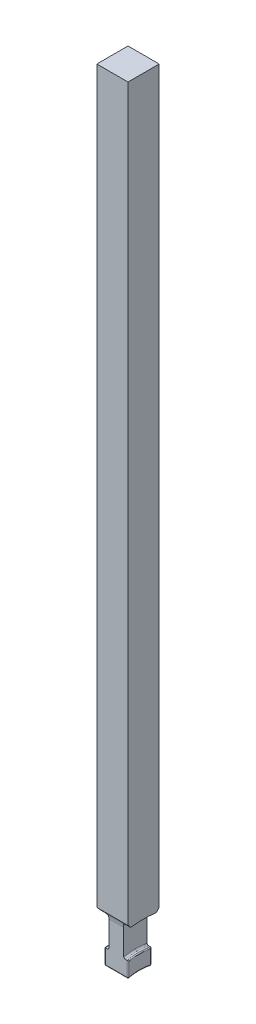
SolidWorks part; units mm, degrees
ref_plane "Front Plane" through (0, 0, 0) normal (0, 0, 1) x (1, 0, 0)
ref_plane "Top Plane" through (0, 0, 0) normal (0, 1, 0) x (1, 0, 0)
ref_plane "Right Plane" through (0, 0, 0) normal (1, 0, 0) x (0, 0, -1)
sketch "Sketch1" plane through (0, 0, 0) normal (1, 0, 0) x (0, 0, -1)
  line L0 (-4, 212) -> (-4, 0)
  line L1 (0, 249.2329) -> (0, 0) construction
  line L2 (4, 212) -> (4, 0)
  line L3 (-4, 212) -> (4, 212)
  line L6 (-4, 0) -> (4, 0)
  arc A0 (-12, 0) -> (12, 0) centre (0, 0) cw construction
  dimension "R" = 12
  dimension "L" = 200
  dimension "T" = 8
extrude "Boss-Extrude1" add sketch "Sketch1" along normal mid plane 8
sketch "Sketch8" plane through (0, 0, 0) normal (1, 0, 0) x (0, 0, -1)
  circle A0 centre (0, 0) radius 12
  arc A1 (12, 0) -> (-12, 0) centre (0, 0) ccw construction
extrude "Cut-Extrude4" cut sketch "Sketch8" against normal through all both and the other way through all
sketch "Sketch2" plane through (0, 0, 0) normal (0, 0, 1) x (1, 0, 0)
  line L0 (4, 16) -> (1.905, 16)
  line L1 (4, 212) -> (4, 11.3137) construction
  line L2 (1.905, 16) -> (1.905, 24)
  line L3 (1.905, 24) -> (4, 24)
  line L4 (4, 24) -> (4, 16)
  line L5 (0, 29.9173) -> (0, 0) construction
  line L6 (-4, 24) -> (-4, 16)
  line L7 (-1.905, 24) -> (-4, 24)
  line L8 (-1.905, 16) -> (-1.905, 24)
  line L9 (-4, 16) -> (-1.905, 16)
  line L10 (-8.8482, 0) -> (24.5305, 0) construction
  dimension "D1" = 3.81
  dimension "D2" = 24
  dimension "D3" = 16
revolve "Cut-Revolve1" cut sketch "Sketch2" angle 360 about L10
sketch "Sketch6" plane through (0, 0, 0) normal (1, 0, 0) x (0, 0, -1)
  line L0 (0, 19.903) -> (0, 0) construction
  line L1 (3, 0) -> (22.05, 0)
  line L2 (3, 0) -> (3, 22.6124)
  line L3 (5.3876, 25) -> (22.05, 25)
  line L4 (22.05, 0) -> (22.05, 25)
  line L9 (-3, 0) -> (-22.05, 0)
  line L10 (-22.05, 0) -> (-22.05, 25)
  line L11 (-5.3876, 25) -> (-22.05, 25)
  line L12 (-3, 0) -> (-3, 22.6124)
  arc A0 (3, 22.6124) -> (5.3876, 25) centre (5.3876, 22.6124) cw
  arc A1 (-3, 22.6124) -> (-5.3876, 25) centre (-5.3876, 22.6124) ccw
  dimension "D3" = 2.3876
  dimension "D1" = 25
  dimension "MT" = 6
  dimension "D2" = 19.05
extrude "Cut-Extrude2" cut sketch "Sketch6" against normal through all both and the other way through all
sketch "Sketch7" plane through (0, 0, 0) normal (0, 0, 1) x (1, 0, 0)
  line L6 (-4, 16) -> (-3, 16)
  line L8 (-4, 16) -> (-4, 0)
  line L9 (-4, 0) -> (-3, 0)
  line L10 (-3, 16) -> (-3, 0)
  line L11 (0, 16.5651) -> (0, 5.9342) construction
  line L12 (3, 16) -> (3, 0)
  line L13 (4, 0) -> (3, 0)
  line L14 (4, 16) -> (4, 0)
  line L15 (4, 16) -> (3, 16)
  dimension "MW" = 6
extrude "Cut-Extrude3" cut sketch "Sketch7" against normal through all both and the other way through all
fillet "Fillet1" radius 0.762 2 edges at (-1.905, 24, 0) (1.905, 24, 0)
fillet "Fillet2" radius 0.381 2 edges at (-1.905, 16, 0) (1.905, 16, 0)
fillet "Fillet3" radius 0.254 10 edges at (3, 13.6676, -3) (3, 13.6676, 3) (3, 16, 0) (-3, 13.6676, 3) (-3, 13.6676, -3) (-3, 16, 0) (3, 12, 0) (-3, 12, 0) (0, 11.619, -3) (0, 11.619, 3)
